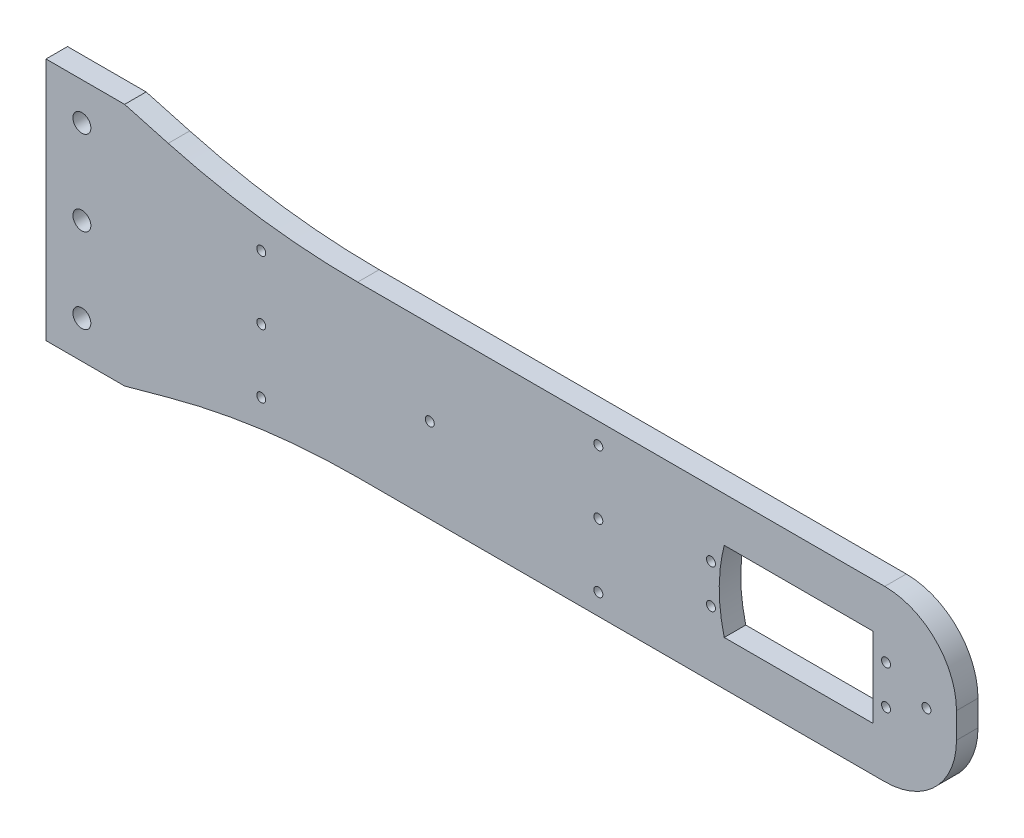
SolidWorks part; units mm, degrees
ref_plane "Front Plane" through (0, 0, 0) normal (0, 0, 1) x (1, 0, 0)
ref_plane "Top Plane" through (0, 0, 0) normal (0, 1, 0) x (1, 0, 0)
ref_plane "Right Plane" through (0, 0, 0) normal (1, 0, 0) x (0, 0, -1)
sketch "Sketch1" plane through (0, 0, 0) normal (0, 0, 1) x (1, 0, 0)
  line L0 (15.0178, 11.0284) -> (16.7567, 11.0284) construction
  line L1 (15.5178, -0.0966) -> (-25.8822, -0.0966)
  line L2 (-214.9422, 51.0284) -> (-214.9422, -28.9716)
  line L3 (15.5178, -0.0966) -> (15.5178, 22.1534)
  line L4 (-5.1822, -0.0966) -> (-5.1822, 4.1385) construction
  line L5 (15.5178, 22.1534) -> (-25.8822, 22.1534)
  line L6 (18.8536, -12.5464) -> (-128.0612, -12.5464)
  line L7 (38.8536, 14.6031) -> (38.8536, 7.4536)
  line L8 (-214.9422, -28.9716) -> (-180.8691, -19.644)
  line L9 (18.8536, 34.6031) -> (-154.9422, 34.6031)
  line L10 (-214.9422, 11.0284) -> (-194.9422, 11.0284) construction
  line L11 (-214.9422, 51.0284) -> (-180.8691, 41.7007)
  line L12 (-194.9422, 34.6031) -> (-194.9422, -12.5464) construction
  line L17 (32.9957, 28.7452) -> (-154.9422, 28.7452) construction
  line L18 (-45.2377, 34.6031) -> (-45.2377, -12.5464) construction
  line L19 (-60.9732, 11.0284) -> (-154.9422, 11.0284) construction
  circle A0 centre (-29.5822, 5.6334) radius 1.25
  circle A1 centre (-29.5822, 16.4234) radius 1.25
  circle A2 centre (19.2178, 5.6334) radius 1.25
  circle A3 centre (19.2178, 16.4234) radius 1.25
  arc A4 (18.8536, -12.5464) -> (38.8536, 7.4536) centre (18.8536, 7.4536) ccw
  arc A5 (38.8536, 14.6031) -> (18.8536, 34.6031) centre (18.8536, 14.6031) ccw
  arc A6 (-128.0612, -12.5464) -> (-180.8691, -19.644) centre (-128.0612, -212.5464) ccw
  arc A7 (-128.0612, 34.6031) -> (-180.8691, 41.7007) centre (-128.0612, 234.6031) cw
  circle A8 centre (-204.9422, 11.0284) radius 2.5
  circle A9 centre (-204.9422, -12.5464) radius 2.5
  circle A10 centre (-204.9422, 34.6031) radius 2.5
  circle A11 centre (30.479, 11.0284) radius 1.25
  circle A12 centre (-154.9422, 28.7452) radius 1.25
  circle A13 centre (-60.9732, 28.7452) radius 1.25
  circle A14 centre (-154.9422, -6.6885) radius 1.25
  circle A15 centre (-60.9732, -6.6885) radius 1.25
  circle A16 centre (-107.9577, 11.0284) radius 1.25
  circle A17 centre (-154.9422, 11.0284) radius 1.25
  circle A18 centre (-60.9732, 11.0284) radius 1.25
  spline S0 degree 2 poles (-25.8822, -0.0966) (-28.6875, 11.0284) (-25.8822, 22.1534) knots 0 0 0 1 1 1
  point P17 (-25.8822, 11.0284)
  point P18 (15.5178, 11.0284)
  point P26 (38.8536, 11.0284)
  point P28 (38.8536, -12.5464)
  point P31 (38.8536, 34.6031)
  point P34 (-154.9422, -12.5464)
  dimension "D1" = 20
  dimension "D2" = 200
extrude "Boss-Extrude2" add sketch "Sketch1" along normal blind 6
sketch "Sketch2" plane through (0, 0, 0) normal (0, 0, -1) x (-1, 0, 0)
  line L0 (214.9422, -22.9719) -> (193.0258, -22.9719)
  line L1 (214.9422, 51.0284) -> (214.9422, -28.9716) construction
  line L2 (214.9422, -28.9716) -> (180.8691, -19.644) construction
  line L3 (193.0258, -22.9719) -> (214.9422, -28.9716)
  line L4 (214.9422, -28.9716) -> (214.9422, -22.9719)
  line L5 (214.9422, 11.0284) -> (189.3961, 11.0284) construction
  line L6 (214.9422, 45.0287) -> (193.0258, 45.0287)
  line L7 (193.0258, 45.0287) -> (214.9422, 51.0284)
  line L8 (214.9422, 51.0284) -> (214.9422, 45.0287)
extrude "Cut-Extrude1" cut sketch "Sketch2" against normal blind 6
